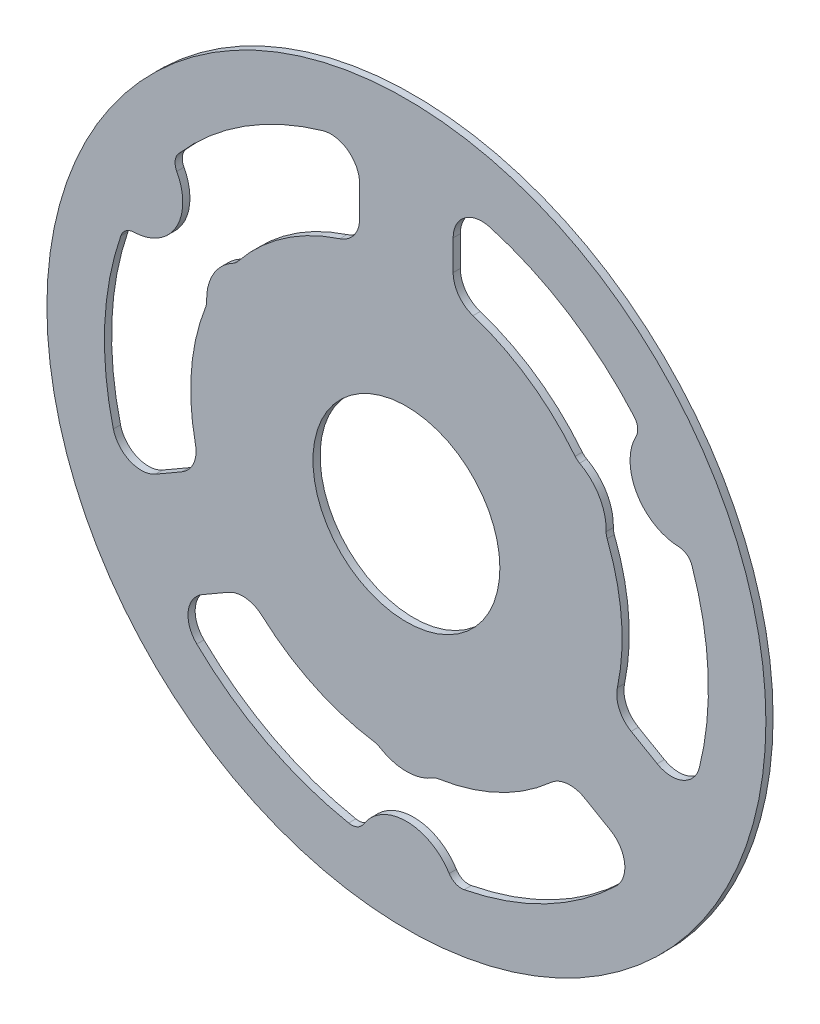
SolidWorks part; units mm, degrees
ref_plane "Plane1" through (0, 0, 0) normal (0, 0, 1) x (1, 0, 0)
ref_plane "Plane2" through (0, 0, 0) normal (0, 1, 0) x (1, 0, 0)
ref_plane "Plane3" through (0, 0, 0) normal (1, 0, 0) x (0, 0, -1)
sketch "Esquisse1" plane through (0, 0, 0) normal (0, 0, 1) x (1, 0, 0)
  line L0 (0, 0) -> (0, 36) construction
  line L1 (0, 0) -> (28.8401, -16.6508) construction
  line L2 (15.6278, -5.2699) -> (17.4389, -6.3156)
  line L3 (0, 0) -> (31.0276, 17.9138) construction
  line L4 (3.25, 16.169) -> (3.25, 18.2603)
  line L5 (-12.3778, -10.8991) -> (-14.1889, -11.9447)
  line L6 (12.3778, -10.8991) -> (14.1889, -11.9447)
  line L7 (-3.25, 16.169) -> (-3.25, 18.2603)
  line L8 (-15.6278, -5.2699) -> (-17.4389, -6.3156)
  circle A0 centre (0, 0) radius 25
  arc A1 (14.6716, -3.1217) -> (13.9594, 5.4896) centre (0, 0) ccw
  arc A2 (20.3798, -5.066) -> (19.8592, 6.8273) centre (0, 0) ccw
  circle A3 centre (0, 0) radius 6.5
  arc A4 (5.8026, 20.1824) -> (3.25, 18.2603) centre (5.25, 18.2603) ccw
  arc A5 (3.25, 16.169) -> (4.6324, 14.2668) centre (5.25, 16.169) ccw
  arc A6 (15.6278, -5.2699) -> (14.6716, -3.1217) centre (16.6278, -3.5379) cw
  arc A7 (20.3798, -5.066) -> (17.4389, -6.3156) centre (18.4389, -4.5835) cw
  arc A8 (11.7339, 9.3443) -> (4.6324, 14.2668) centre (0, 0) ccw
  arc A9 (13.8905, 5.8877) -> (12.0442, 9.0857) centre (10.3923, 6) ccw
  arc A10 (-2.2255, -14.834) -> (-1.8464, -14.9734) centre (-2.3739, -15.8229) cw
  arc A11 (15.9689, 12.6555) -> (18.9444, 7.5017) centre (19.0526, 11) ccw
  arc A12 (15.8422, 13.785) -> (15.9689, 12.6555) centre (15.0878, 13.1285) cw
  arc A13 (15.8422, 13.785) -> (5.8026, 20.1824) centre (0, 0) ccw
  arc A14 (19.8592, 6.8273) -> (18.9444, 7.5017) centre (18.9135, 6.5021) ccw
  arc A15 (13.8905, 5.8877) -> (13.9594, 5.4896) centre (14.89, 5.8556) ccw
  arc A16 (11.7339, 9.3443) -> (12.0442, 9.0857) centre (12.5161, 9.9673) ccw
  arc A17 (1.8464, -14.9734) -> (2.2255, -14.834) centre (2.3739, -15.8229) cw
  arc A18 (4.017, -20.6122) -> (2.9756, -20.1572) centre (3.8257, -19.6307) cw
  arc A19 (-4.017, -20.6122) -> (-14.5772, -15.1164) centre (0, 0) cw
  arc A20 (-4.017, -20.6122) -> (-2.9756, -20.1572) centre (-3.8257, -19.6307) ccw
  arc A21 (-2.9756, -20.1572) -> (2.9756, -20.1572) centre (0, -22) cw
  arc A22 (1.8464, -14.9734) -> (-1.8464, -14.9734) centre (0, -12) cw
  arc A23 (-2.2255, -14.834) -> (-10.0392, -11.1451) centre (0, 0) cw
  arc A24 (14.5772, -15.1164) -> (14.1889, -11.9447) centre (13.1889, -13.6768) ccw
  arc A25 (12.3778, -10.8991) -> (10.0392, -11.1451) centre (11.3778, -12.6311) ccw
  arc A26 (-12.3778, -10.8991) -> (-10.0392, -11.1451) centre (-11.3778, -12.6311) cw
  arc A27 (-14.5772, -15.1164) -> (-14.1889, -11.9447) centre (-13.1889, -13.6768) cw
  arc A28 (14.5772, -15.1164) -> (4.017, -20.6122) centre (0, 0) cw
  arc A29 (10.0392, -11.1451) -> (2.2255, -14.834) centre (0, 0) cw
  arc A30 (-11.7339, 9.3443) -> (-12.0442, 9.0857) centre (-12.5161, 9.9673) cw
  arc A31 (-13.8905, 5.8877) -> (-13.9594, 5.4896) centre (-14.89, 5.8556) cw
  arc A32 (-19.8592, 6.8273) -> (-18.9444, 7.5017) centre (-18.9135, 6.5021) cw
  arc A33 (-15.8422, 13.785) -> (-5.8026, 20.1824) centre (0, 0) cw
  arc A34 (-15.8422, 13.785) -> (-15.9689, 12.6555) centre (-15.0878, 13.1285) ccw
  arc A35 (-15.9689, 12.6555) -> (-18.9444, 7.5017) centre (-19.0526, 11) cw
  arc A36 (-13.8905, 5.8877) -> (-12.0442, 9.0857) centre (-10.3923, 6) cw
  arc A37 (-11.7339, 9.3443) -> (-4.6324, 14.2668) centre (0, 0) cw
  arc A38 (-20.3798, -5.066) -> (-17.4389, -6.3156) centre (-18.4389, -4.5835) ccw
  arc A39 (-15.6278, -5.2699) -> (-14.6716, -3.1217) centre (-16.6278, -3.5379) ccw
  arc A40 (-3.25, 16.169) -> (-4.6324, 14.2668) centre (-5.25, 16.169) cw
  arc A41 (-5.8026, 20.1824) -> (-3.25, 18.2603) centre (-5.25, 18.2603) cw
  arc A42 (-20.3798, -5.066) -> (-19.8592, 6.8273) centre (0, 0) cw
  arc A43 (-14.6716, -3.1217) -> (-13.9594, 5.4896) centre (0, 0) cw
  point P13 (3.25, 20.747)
  point P16 (3.25, 14.6437)
  point P37 (11.8676, 9.1739)
  dimension "D1" = 50
  dimension "D2" = 30
  dimension "D3" = 42
  dimension "D5" = 13
  dimension "D8" = 2
  dimension "D9" = 2
  dimension "D10" = 7
  dimension "D11" = 7
  dimension "D12" = 1
  dimension "D4" = 120
  dimension "D6" = 3.25
  dimension "D7" = 60
extrude "Base-Extrusion" add sketch "Esquisse1" along normal blind 0.5
